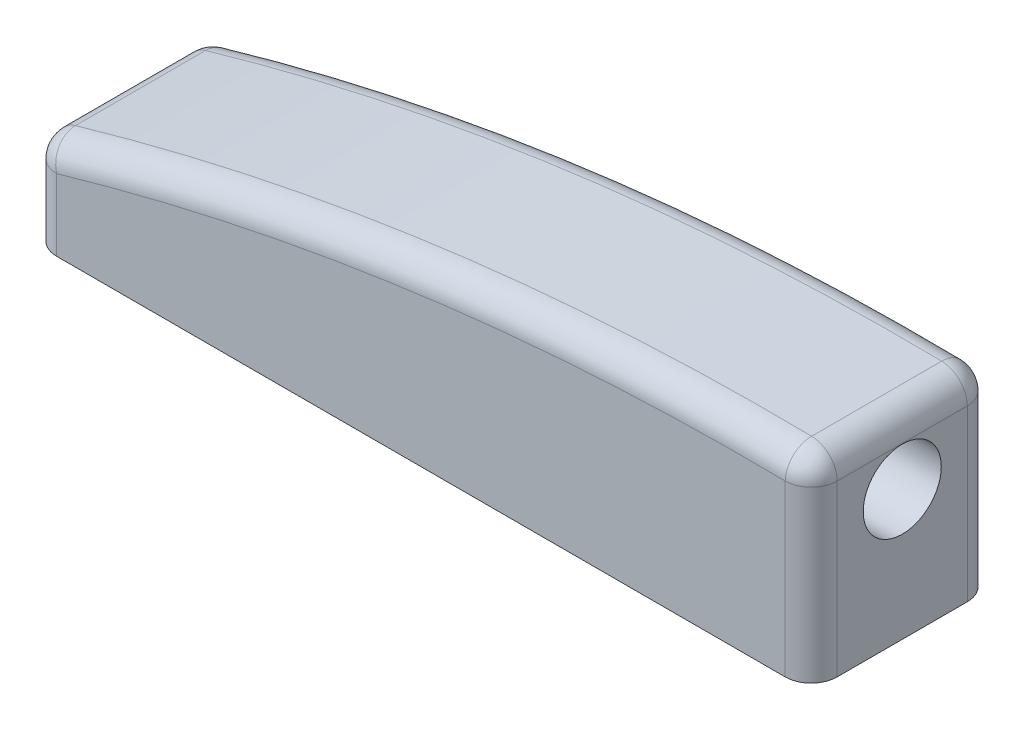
SolidWorks part; units mm, degrees
ref_plane "Plan de face" through (0, 0, 0) normal (0, 0, 1) x (1, 0, 0)
ref_plane "Plan de dessus" through (0, 0, 0) normal (0, 1, 0) x (1, 0, 0)
ref_plane "Plan de droite" through (0, 0, 0) normal (1, 0, 0) x (0, 0, -1)
sketch "Esquisse1" plane through (0, 0, 0) normal (0, 0, 1) x (1, 0, 0)
  line L0 (-68.2676, 0) -> (231.7324, 0)
  line L1 (-68.2676, 0) -> (-68.2676, 35)
  line L2 (231.7324, 0) -> (231.7324, 75)
  arc A0 (-68.2676, 35) -> (231.7324, 75) centre (206.7188, -882.3986) cw
  dimension "D1" = 300
  dimension "D2" = 35
  dimension "D3" = 75
extrude "Extrusion1" add sketch "Esquisse1" along normal mid plane 70
fillet "Congé2" radius 10 8 edges at (80.1423, 66.9254, -35) (-68.2676, 35, 0) (-68.2676, 17.5, -35) (-68.2676, 17.5, 35) (80.1423, 66.9254, 35) (231.7324, 37.5, -35) (231.7324, 75, 0) (231.7324, 37.5, 35)
sketch "Esquisse2" plane through (231.7324, 0, 0) normal (1, 0, 0) x (0, 0, -1)
  line L0 (-25, 0) -> (25, 0) construction
  circle A0 centre (0, 50) radius 15
  dimension "D1" = 30
  dimension "D2" = 50
extrude "Enlèv. mat.-Extru.1" cut sketch "Esquisse2" against normal blind 100
shell "Coque2" thickness 5
